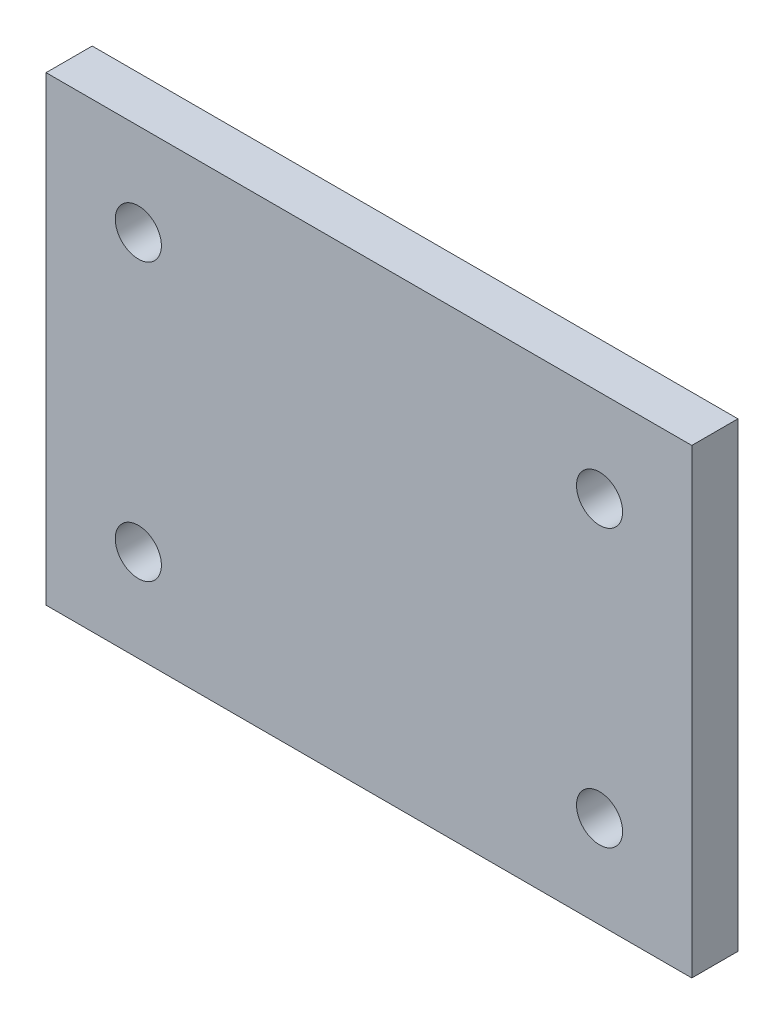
SolidWorks part; units mm, degrees
ref_plane "Plan de face" through (0, 0, 0) normal (0, 0, 1) x (1, 0, 0)
ref_plane "Plan de dessus" through (0, 0, 0) normal (0, 1, 0) x (1, 0, 0)
ref_plane "Plan de droite" through (0, 0, 0) normal (1, 0, 0) x (0, 0, -1)
sketch "Esquisse1" plane through (0, 0, 0) normal (0, 0, 1) x (1, 0, 0)
  line L1 (0, 0) -> (70, 0)
  line L2 (0, 0) -> (0, 50)
  line L3 (0, 50) -> (70, 50)
  line L4 (70, 0) -> (70, 50)
  dimension "D1" = 70
  dimension "D2" = 50
extrude "Boss.-Extru.1" add sketch "Esquisse1" along normal blind 5
sketch "Esquisse2" plane through (0, 0, 5) normal (0, 0, 1) x (1, 0, 0)
  line L0 (70, 50) -> (0, 50) construction
  line L1 (0, 50) -> (0, 0) construction
  line L2 (0, 0) -> (70, 0) construction
  line L3 (70, 0) -> (70, 50) construction
  circle A0 centre (10, 40) radius 2.5
  circle A1 centre (60, 40) radius 2.5
  circle A2 centre (60, 10) radius 2.5
  circle A3 centre (10, 10) radius 2.5
  dimension "D1" = 10
  dimension "D3" = 10
  dimension "D2" = 10
  dimension "D4" = 10
  dimension "D5" = 10
  dimension "D6" = 10
  dimension "D7" = 10
  dimension "D8" = 10
extrude "Enlèv. mat.-Extru.1" cut sketch "Esquisse2" against normal through all
